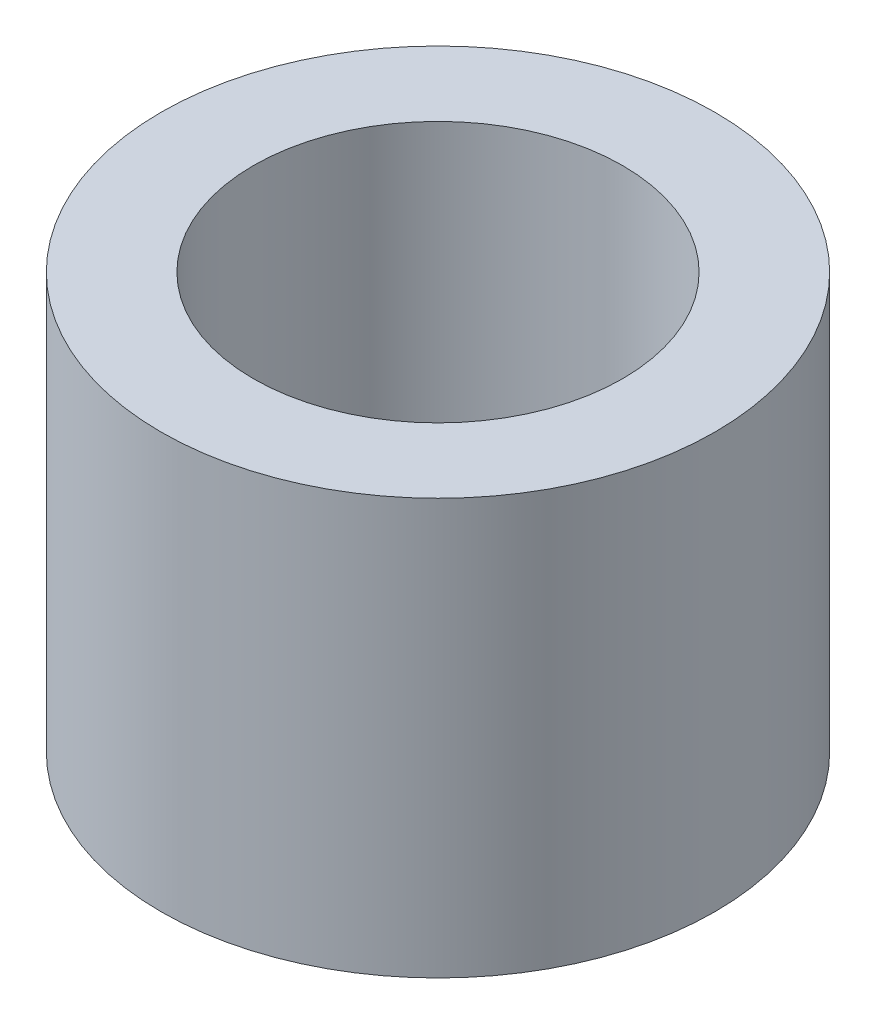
SolidWorks part; units mm, degrees
ref_plane "Front Plane" through (0, 0, 0) normal (0, 0, 1) x (1, 0, 0)
ref_plane "Top Plane" through (0, 0, 0) normal (0, 1, 0) x (1, 0, 0)
ref_plane "Right Plane" through (0, 0, 0) normal (1, 0, 0) x (0, 0, -1)
sketch "Sketch1" plane through (0, 0, 0) normal (0, 1, 0) x (1, 0, 0)
  circle A0 centre (0, 0) radius 2
  circle A1 centre (0, 0) radius 3
  dimension "D1" = 4
  dimension "D2" = 6
extrude "Extrude1" add sketch "Sketch1" along normal blind 4.5
